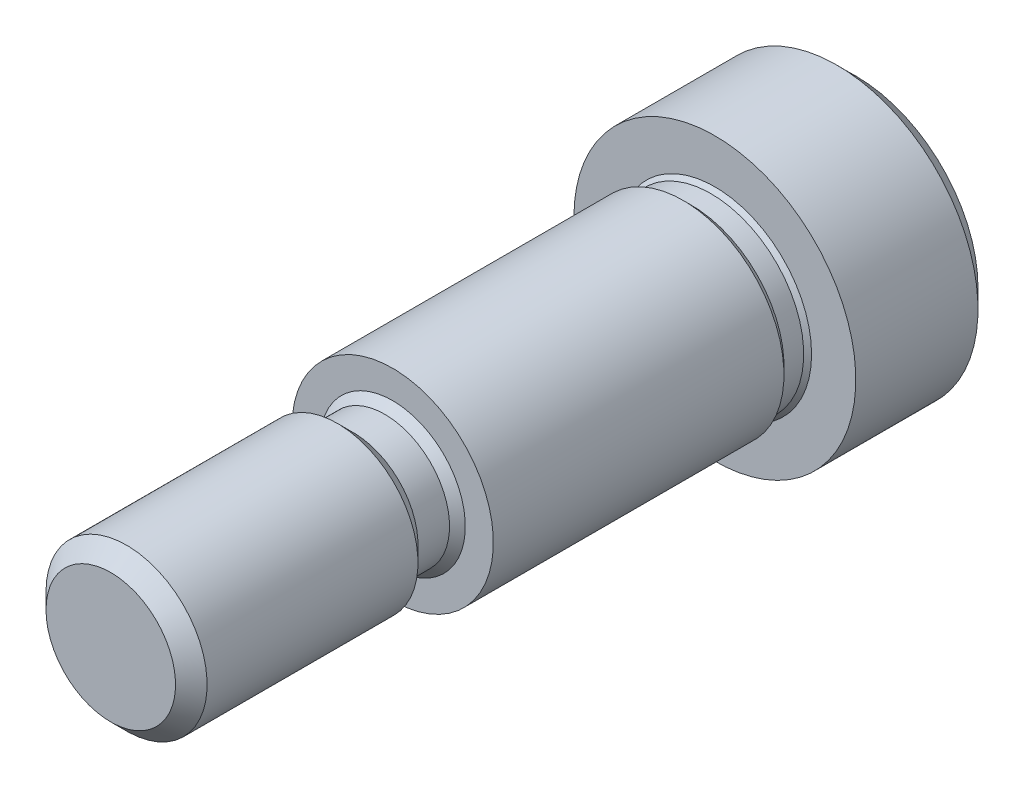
SolidWorks part; units mm, degrees
ref_plane "Front" through (0, 0, 0) normal (0, 0, 1) x (1, 0, 0)
ref_plane "Top" through (0, 0, 0) normal (0, 1, 0) x (1, 0, 0)
ref_plane "Right" through (0, 0, 0) normal (1, 0, 0) x (0, 0, -1)
sketch "Logo3_Revol_Axis" plane through (0, 0, 0) normal (0, 1, 0) x (1, 0, 0)
  line L0 (0, -25.3777) -> (0, 25.3777) construction
sketch "Logo3_bib1" plane through (0, 0, 0) normal (0, -1, 0) x (-1, 0, 0)
  line L0 (0, 62.3527) -> (0, -65.5595) construction
  line L1 (3.9688, 0) -> (2.8639, 0)
  line L2 (3.9688, 0) -> (3.9688, 11.4554)
  line L3 (3.9688, 11.4554) -> (3.6576, 11.7666)
  line L4 (5.5563, 17.5167) -> (4.8154, 18.2575)
  line L5 (3.8132, 12.7) -> (5.5563, 12.7)
  line L6 (5.5563, 12.7) -> (5.5563, 17.5167)
  line L7 (4.8154, 18.2575) -> (0, 18.2575)
  line L8 (3.6576, 11.7666) -> (3.6576, 12.5444)
  line L9 (3.175, -2.1781) -> (3.175, -10.4902)
  line L11 (3.175, -10.4902) -> (2.5527, -11.1125)
  line L12 (2.5527, -11.1125) -> (0, -11.1125)
  line L13 (0, -11.1125) -> (0, 18.2575)
  line L14 (2.5527, -0.3112) -> (2.5527, -1.5558)
  line L15 (2.5527, -1.5558) -> (3.175, -2.1781)
  line L16 (3.6576, 12.5444) -> (3.8132, 12.7)
  line L17 (2.5527, -0.3112) -> (2.8639, 0)
  point P18 (5.5563, 18.2575)
revolve "Revolve1" add sketch "Logo3_bib1" angle 360 about L0
sketch "Logo3_bib2" plane through (0, 0, -18.2575) normal (0, 0, -1) x (1, 0, 0)
  line L1 (2.2921, 0) -> (1.146, 1.985)
  line L2 (1.146, 1.985) -> (-1.146, 1.985)
  line L3 (-1.146, 1.985) -> (-2.2921, 0)
  line L4 (-2.2921, 0) -> (-1.146, -1.985)
  line L5 (-1.146, -1.985) -> (1.146, -1.985)
  line L6 (1.146, -1.985) -> (2.2921, 0)
  circle A0 centre (0, 0) radius 1.985 construction
  dimension "Logo3_c1" = 3.97
extrude "Cut-Extrude1" cut sketch "Logo3_bib2" against normal blind 3.705
equation "\"D2@Cosmetic Thread1\" = \"Logo3_dm-pas@Logo3_bib1\""
